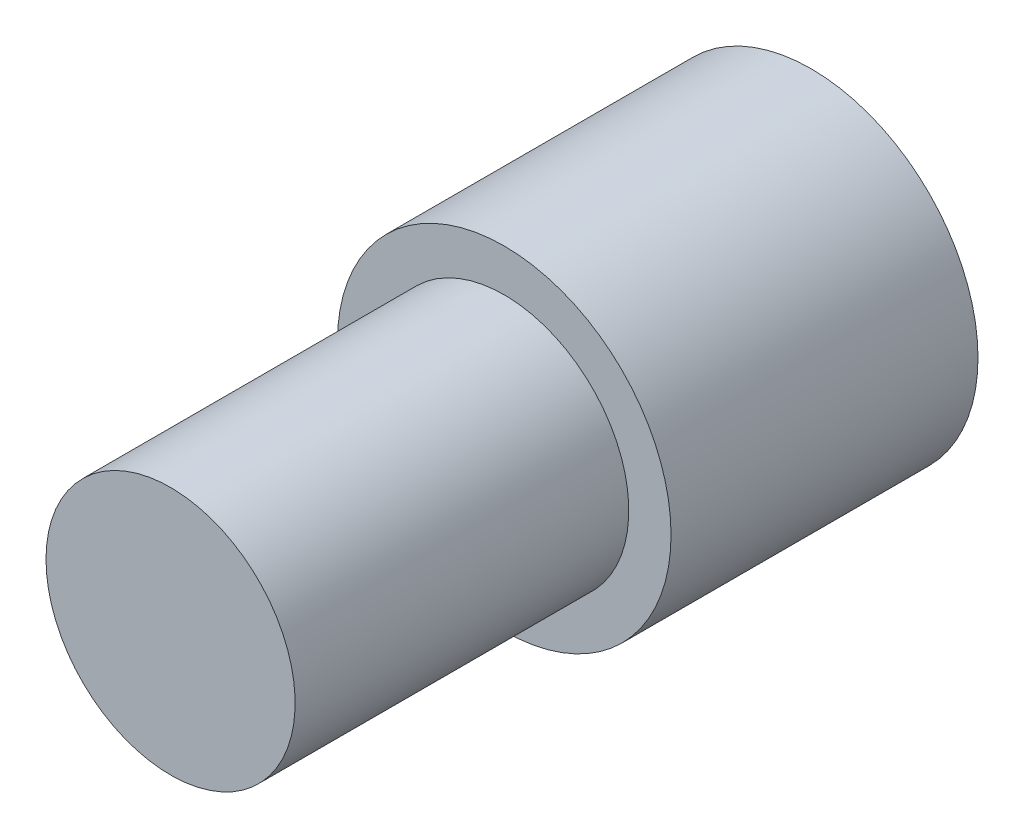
SolidWorks part; units mm, degrees
ref_plane "Front Plane" through (0, 0, 0) normal (0, 0, 1) x (1, 0, 0)
ref_plane "Top Plane" through (0, 0, 0) normal (0, 1, 0) x (1, 0, 0)
ref_plane "Right Plane" through (0, 0, 0) normal (1, 0, 0) x (0, 0, -1)
sketch "Sketch1" plane through (0, 0, 0) normal (0, 0, 1) x (1, 0, 0)
  circle A0 centre (0, 0) radius 9.525
  dimension "D1" = 19.05
extrude "Boss-Extrude1" add sketch "Sketch1" along normal blind 17.526
sketch "Sketch2" plane through (0, 0, 17.526) normal (0, 0, 1) x (1, 0, 0)
  circle A0 centre (0, 0) radius 7.112
  circle A1 centre (0, 0) radius 9.525
  circle A2 centre (0, 0) radius 9.525
  dimension "D2" = 14.224
  dimension "D1" = 0
extrude "Boss-Extrude2" add sketch "Sketch2" along normal blind 19.05 contours A0
